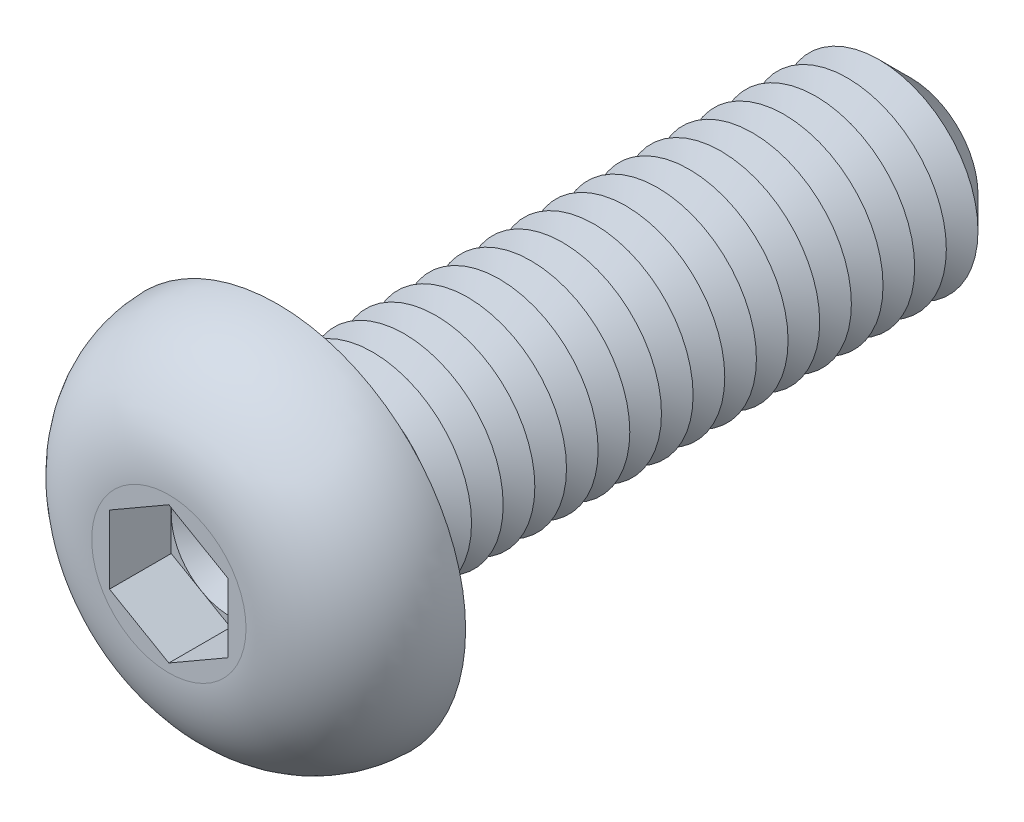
SolidWorks part; units mm, degrees
ref_plane "Front Plane" through (0, 0, 0) normal (0, 0, 1) x (1, 0, 0)
ref_plane "Top Plane" through (0, 0, 0) normal (0, 1, 0) x (1, 0, 0)
ref_plane "Right Plane" through (0, 0, 0) normal (1, 0, 0) x (0, 0, -1)
sketch "Sketch1" plane through (0, 0, 0) normal (1, 0, 0) x (0, 0, -1)
  line L0 (-47.9342, 0) -> (60.3146, 0) construction
sketch "Sketch2" plane through (0, 0, 0) normal (1, 0, 0) x (0, 0, -1)
  line L0 (0, 0) -> (-2.75, 0)
  line L1 (-47.9342, 0) -> (60.3146, 0) construction
  line L2 (-2.75, 0) -> (-2.75, 1.9504)
  line L3 (0, 4.75) -> (0, 0)
  arc A0 (-2.75, 1.9504) -> (0, 4.75) centre (0.05, 1.9504) cw
  dimension "D1" = 2.8
  dimension "D2" = 2.75
  dimension "D3" = 4.75
revolve "Revolve1" add sketch "Sketch2" angle 360 about L0
sketch "Sketch3" plane through (0, 0, 2.75) normal (0, 0, 1) x (1, 0, 0)
  line L1 (0, 1.7321) -> (-1.5, 0.866)
  line L2 (-1.5, 0.866) -> (-1.5, -0.866)
  line L3 (-1.5, -0.866) -> (0, -1.7321)
  line L4 (0, -1.7321) -> (1.5, -0.866)
  line L5 (1.5, -0.866) -> (1.5, 0.866)
  line L6 (1.5, 0.866) -> (0, 1.7321)
  circle A0 centre (0, 0) radius 1.5 construction
  dimension "D1" = 3
extrude "Cut-Extrude1" cut sketch "Sketch3" against normal blind 1.56
sketch "Sketch4" plane through (0, 0, 0) normal (0, 0, -1) x (-1, 0, 0)
  circle A0 centre (0, 0) radius 2.5
  dimension "D1" = 5
extrude "Boss-Extrude1" add sketch "Sketch4" along normal blind 16
chamfer "Chamfer1" distance 0.8 angle 45 1 edges at (-2.5, 0, -16)
sketch "Sketch5" plane through (0, 0, 0) normal (1, 0, 0) x (0, 0, -1)
  line L0 (0.8, 2.5) -> (1.6, 2.5)
  line L1 (15.2, 2.5) -> (0, 2.5) construction
  line L2 (1.6, 2.5) -> (1.2, 1.8072)
  line L3 (1.2, 1.8072) -> (0.8, 2.5)
  line L4 (0, -4.75) -> (0, 4.75) construction
  line L5 (15.2, 2.5) -> (0, 2.5) construction
  dimension "D1" = 0.8
  dimension "D2" = 0.8
revolve "Cut-Revolve1" cut sketch "Sketch5" angle 360 about L0
pattern_linear "LPattern1" count 18 spacing 0.8 along (0, 0, -1) of "Cut-Revolve1"
fillet "Fillet2" radius 0.4 1 edges at (2.5, 0, 0)
sketch "Sketch6" plane through (0, 0, 1.19) normal (0, 0, 1) x (1, 0, 0)
  line L0 (0, -1.7321) -> (1.5, -0.866) construction
  circle A0 centre (0, 0) radius 1.5
extrude "Cut-Extrude2" cut sketch "Sketch6" against normal through all draft 60
